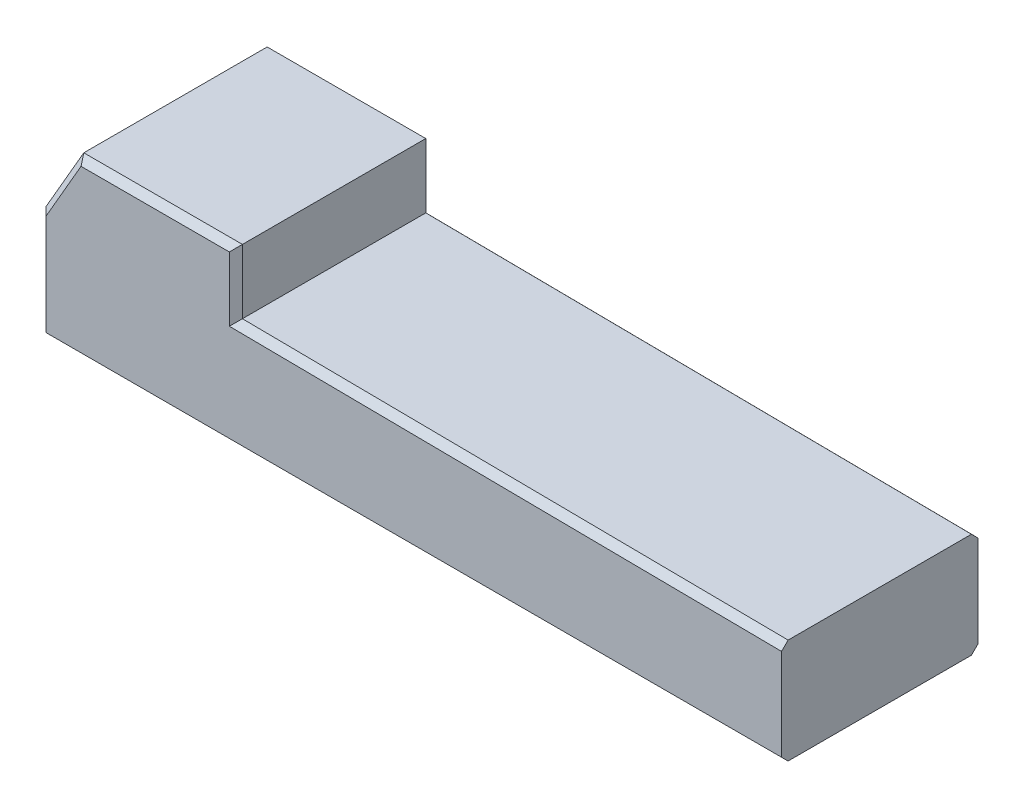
SolidWorks part; units mm, degrees
ref_plane "Front Plane" through (0, 0, 0) normal (0, 0, 1) x (1, 0, 0)
ref_plane "Top Plane" through (0, 0, 0) normal (0, 1, 0) x (1, 0, 0)
ref_plane "Right Plane" through (0, 0, 0) normal (1, 0, 0) x (0, 0, -1)
sketch "BodySke" plane through (0, 0, 0) normal (0, 0, 1) x (1, 0, 0)
  line L0 (0, 0) -> (2000, 0) construction
  line L1 (0, 0) -> (0, 20) construction
  line L2 (0, 20) -> (2000, 0) construction
  line L3 (80, 19.2) -> (80, 0)
  line L4 (80, 0) -> (0, 0)
  line L5 (0, 20) -> (80, 19.2)
  line L6 (0, 0) -> (-20, 0)
  line L7 (-20, 0) -> (-20, 20.2) construction
  line L8 (-20, 20.2) -> (0, 20)
  line L9 (-20, 20.2) -> (-20, 32)
  line L10 (-20, 32) -> (-56, 32) construction
  line L11 (-56, 32) -> (-56, 0) construction
  line L12 (-56, 0) -> (-20, 0)
  line L13 (-56, 20) -> (-49.0718, 32)
  line L14 (-49.0718, 32) -> (-20, 32)
  line L15 (-56, 20) -> (-56, 0)
  dimension "Height" = 20
  dimension "D2" = 2000
  dimension "Length" = 100
  dimension "Head_Height" = 32
  dimension "Width" = 36
  dimension "Angle" = 30
  dimension "D3" = 20
extrude "BaseBody" add sketch "BodySke" along normal blind 36
chamfer "Chamfer1" distance 1.2 angle 45 12 edges at (30, 19.7, 0) (12, 0, 0) (12, 0, 36) (30, 19.7, 36) (-34.5359, 32, 0) (-52.5359, 26, 0) (-56, 10, 0) (-56, 10, 36) (-52.5359, 26, 36) (-34.5359, 32, 36) (-20, 26.1, 36) (-20, 26.1, 0)
equation "\"D2@BodySke\" = \"Height@BodySke\" * 100"
equation "\"D3@BodySke\" = \"Height@BodySke\""
equation "\"Width@BaseBody\" = \"Width@BodySke\""
